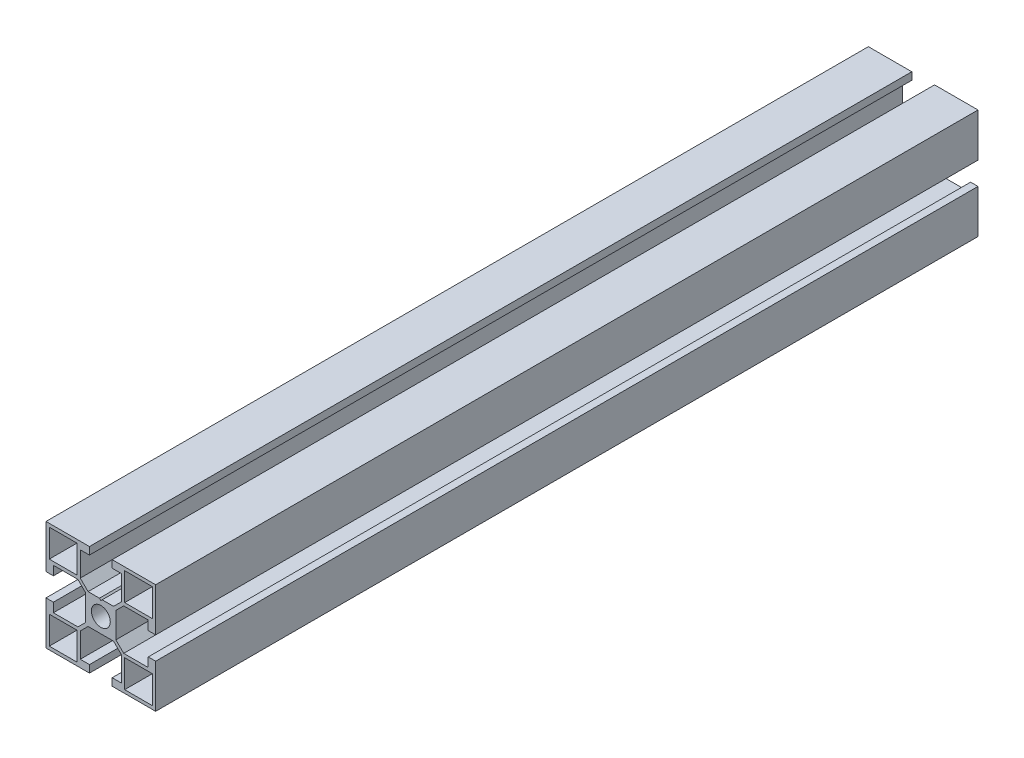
SolidWorks part; units mm, degrees
ref_plane "前视" through (0, 0, 0) normal (0, 0, 1) x (1, 0, 0)
ref_plane "上视" through (0, 0, 0) normal (0, 1, 0) x (1, 0, 0)
ref_plane "右视" through (0, 0, 0) normal (1, 0, 0) x (0, 0, -1)
sketch "Model" plane through (0, 0, 0) normal (0, 0, 1) x (1, 0, 0)
  line L0 (4845.6762, 1534.5503) -> (4835.5762, 1534.5503)
  line L1 (4835.5762, 1534.5503) -> (4835.5762, 1524.4503)
  line L2 (4835.5762, 1524.4503) -> (4845.6762, 1524.4503)
  line L3 (4845.6762, 1524.4503) -> (4845.6762, 1534.5503)
  line L4 (4818.1762, 1534.5503) -> (4808.0762, 1534.5503)
  line L5 (4808.0762, 1534.5503) -> (4808.0762, 1524.4503)
  line L6 (4808.0762, 1524.4503) -> (4818.1762, 1524.4503)
  line L7 (4818.1762, 1524.4503) -> (4818.1762, 1534.5503)
  line L8 (4808.0762, 1496.9503) -> (4818.1762, 1496.9503)
  line L9 (4818.1762, 1496.9503) -> (4818.1762, 1507.0503)
  line L10 (4818.1762, 1507.0503) -> (4808.0762, 1507.0503)
  line L11 (4808.0762, 1507.0503) -> (4808.0762, 1496.9503)
  line L12 (4835.5762, 1496.9503) -> (4845.6762, 1496.9503)
  line L13 (4845.6762, 1496.9503) -> (4845.6762, 1507.0503)
  line L14 (4845.6762, 1507.0503) -> (4835.5762, 1507.0503)
  line L15 (4835.5762, 1507.0503) -> (4835.5762, 1496.9503)
  line L16 (4827.3762, 1521.2503) -> (4826.8762, 1520.7503)
  line L17 (4826.8762, 1520.7503) -> (4826.3762, 1521.2503)
  line L18 (4826.3762, 1521.2503) -> (4822.2248, 1521.2503)
  line L19 (4822.2248, 1521.2503) -> (4819.3762, 1524.0988)
  line L20 (4819.3762, 1524.0988) -> (4819.3762, 1533.0503)
  line L21 (4819.3762, 1533.0503) -> (4822.7262, 1533.0503)
  line L22 (4822.7262, 1533.0503) -> (4822.7262, 1535.7503)
  line L23 (4822.7262, 1535.7503) -> (4806.8762, 1535.7503)
  line L24 (4806.8762, 1535.7503) -> (4806.8762, 1519.9003)
  line L25 (4806.8762, 1519.9003) -> (4809.5762, 1519.9003)
  line L26 (4809.5762, 1519.9003) -> (4809.5762, 1523.2503)
  line L27 (4809.5762, 1523.2503) -> (4818.5277, 1523.2503)
  line L28 (4818.5277, 1523.2503) -> (4821.3762, 1520.4018)
  line L29 (4821.3762, 1520.4018) -> (4821.3762, 1511.0988)
  line L30 (4821.3762, 1511.0988) -> (4818.5277, 1508.2503)
  line L31 (4818.5277, 1508.2503) -> (4809.5762, 1508.2503)
  line L32 (4809.5762, 1508.2503) -> (4809.5762, 1511.6003)
  line L33 (4809.5762, 1511.6003) -> (4806.8762, 1511.6003)
  line L34 (4806.8762, 1511.6003) -> (4806.8762, 1495.7503)
  line L35 (4806.8762, 1495.7503) -> (4822.7262, 1495.7503)
  line L36 (4822.7262, 1495.7503) -> (4822.7262, 1498.4503)
  line L37 (4822.7262, 1498.4503) -> (4819.3762, 1498.4503)
  line L38 (4819.3762, 1498.4503) -> (4819.3762, 1507.4018)
  line L39 (4819.3762, 1507.4018) -> (4822.2248, 1510.2503)
  line L40 (4822.2248, 1510.2503) -> (4831.5277, 1510.2503)
  line L41 (4831.5277, 1510.2503) -> (4834.3762, 1507.4018)
  line L42 (4834.3762, 1507.4018) -> (4834.3762, 1498.4503)
  line L43 (4834.3762, 1498.4503) -> (4831.0262, 1498.4503)
  line L44 (4831.0262, 1498.4503) -> (4831.0262, 1495.7503)
  line L45 (4831.0262, 1495.7503) -> (4846.8762, 1495.7503)
  line L46 (4846.8762, 1495.7503) -> (4846.8762, 1511.6003)
  line L47 (4846.8762, 1511.6003) -> (4844.1762, 1511.6003)
  line L48 (4844.1762, 1511.6003) -> (4844.1762, 1508.2503)
  line L49 (4844.1762, 1508.2503) -> (4835.2248, 1508.2503)
  line L50 (4835.2248, 1508.2503) -> (4832.3762, 1511.0988)
  line L51 (4832.3762, 1511.0988) -> (4832.3762, 1520.4018)
  line L52 (4832.3762, 1520.4018) -> (4835.2248, 1523.2503)
  line L53 (4835.2248, 1523.2503) -> (4844.1762, 1523.2503)
  line L54 (4844.1762, 1523.2503) -> (4844.1762, 1519.9003)
  line L55 (4844.1762, 1519.9003) -> (4846.8762, 1519.9003)
  line L56 (4846.8762, 1519.9003) -> (4846.8762, 1535.7503)
  line L57 (4846.8762, 1535.7503) -> (4831.0262, 1535.7503)
  line L58 (4831.0262, 1535.7503) -> (4831.0262, 1533.0503)
  line L59 (4831.0262, 1533.0503) -> (4834.3762, 1533.0503)
  line L60 (4834.3762, 1533.0503) -> (4834.3762, 1524.0988)
  line L61 (4834.3762, 1524.0988) -> (4831.5277, 1521.2503)
  line L62 (4831.5277, 1521.2503) -> (4827.3762, 1521.2503)
  circle A0 centre (4826.8762, 1515.7503) radius 3.45
extrude "凸台-拉伸1" add sketch "Model" along normal blind 300
